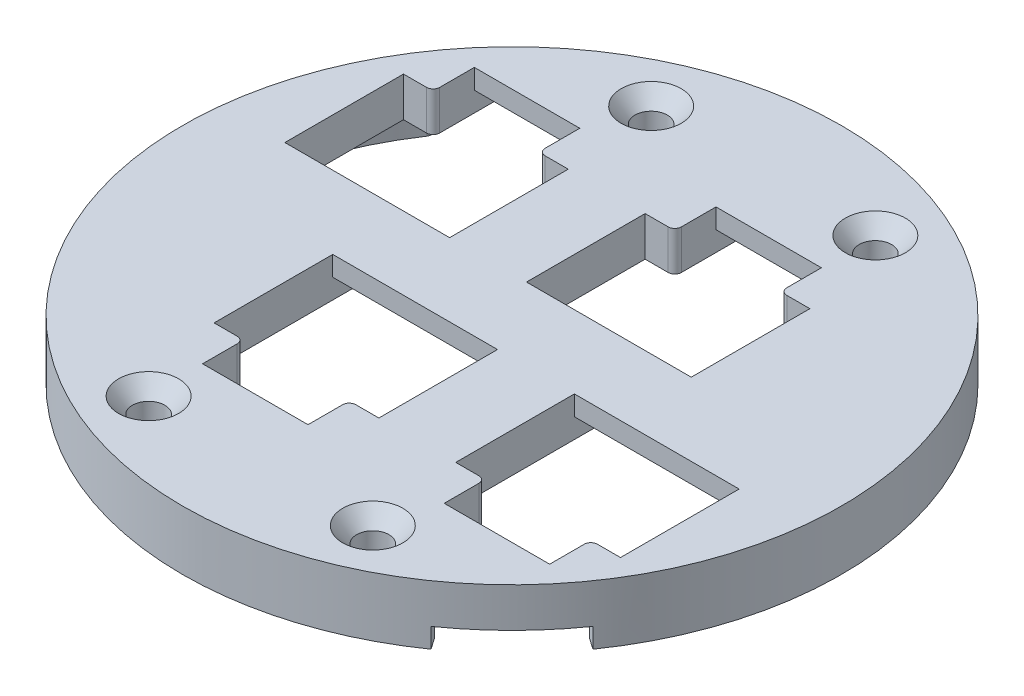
SolidWorks part; units mm, degrees
other "<a_base>-<Holes Pattern>"
ref_plane "Front Plane" through (0, 0, 0) normal (0, 0, 1) x (1, 0, 0)
ref_plane "Top Plane" through (0, 0, 0) normal (0, 1, 0) x (1, 0, 0)
ref_plane "Right Plane" through (0, 0, 0) normal (1, 0, 0) x (0, 0, -1)
inserted part "a_base"
sketch "Sketch2" plane through (0, 1.5, 0) normal (0, 1, 0) x (1, 0, 0)
  circle A0 centre (0, 0) radius 47
  circle A1 centre (0, 0) radius 50
  circle A2 centre (0, 0) radius 47 construction
  dimension "D1" = 3
extrude "Outer Ring" add sketch "Sketch2" against normal blind 9
sketch "Sketch3" plane through (0, -1.5, 0) normal (0, -1, 0) x (1, 0, 0)
  line L0 (27.5, 28.2843) -> (-9.1667, 28.2843) construction
  line L1 (9.1667, -28.2843) -> (-27.5, -28.2843) construction
  line L2 (0, 0) -> (0, 47) construction
  line L3 (47, 0) -> (-47, 0) construction
  line L4 (27.5, 28.2843) -> (27.5, 0) construction
  line L5 (-9.1667, 28.2843) -> (-9.1667, -28.2843) construction
  line L6 (9.1667, -28.2843) -> (9.1667, 28.2843) construction
  line L7 (-27.5, -28.2843) -> (-27.5, 0) construction
  line L8 (35.5, 23.5343) -> (40, 23.5343)
  line L9 (35.5, 29.7843) -> (19.5, 29.7843)
  line L10 (35.5, 29.7843) -> (35.5, 23.5343)
  line L11 (40, 23.5343) -> (40, 5.5343)
  line L12 (19.5, 29.7843) -> (19.5, 23.5343)
  line L13 (40, 5.5343) -> (15, 5.5343)
  line L14 (15, 5.5343) -> (15, 23.5343)
  line L15 (15, 23.5343) -> (19.5, 23.5343)
  line L16 (40, 14.5343) -> (15, 14.5343) construction
  line L17 (27.5, 28.2843) -> (27.5, 29.7843) construction
  line L18 (-1.1667, 29.7843) -> (-17.1667, 29.7843)
  line L19 (-17.1667, 29.7843) -> (-17.1667, 23.5343)
  line L20 (-17.1667, 23.5343) -> (-21.6667, 23.5343)
  line L21 (-21.6667, 23.5343) -> (-21.6667, 5.5343)
  line L22 (-21.6667, 5.5343) -> (3.3333, 5.5343)
  line L23 (3.3333, 5.5343) -> (3.3333, 23.5343)
  line L24 (3.3333, 23.5343) -> (-1.1667, 23.5343)
  line L25 (-1.1667, 23.5343) -> (-1.1667, 29.7843)
  line L26 (17.1667, -29.7843) -> (1.1667, -29.7843)
  line L27 (1.1667, -29.7843) -> (1.1667, -23.5343)
  line L28 (1.1667, -23.5343) -> (-3.3333, -23.5343)
  line L29 (-3.3333, -23.5343) -> (-3.3333, -5.5343)
  line L30 (-3.3333, -5.5343) -> (21.6667, -5.5343)
  line L31 (21.6667, -5.5343) -> (21.6667, -23.5343)
  line L32 (21.6667, -23.5343) -> (17.1667, -23.5343)
  line L33 (17.1667, -23.5343) -> (17.1667, -29.7843)
  line L34 (9.1667, -28.2843) -> (9.1667, -29.7843) construction
  line L35 (-19.5, -29.7843) -> (-35.5, -29.7843)
  line L36 (-35.5, -29.7843) -> (-35.5, -23.5343)
  line L37 (-35.5, -23.5343) -> (-40, -23.5343)
  line L38 (-40, -23.5343) -> (-40, -5.5343)
  line L39 (-40, -5.5343) -> (-15, -5.5343)
  line L40 (-15, -5.5343) -> (-15, -23.5343)
  line L41 (-15, -23.5343) -> (-19.5, -23.5343)
  line L42 (-19.5, -23.5343) -> (-19.5, -29.7843)
  circle A0 centre (0, 0) radius 47 construction
  dimension "D1" = 1.5
  dimension "D2" = 25
  dimension "D3" = 22.75
  dimension "D4" = 18
  dimension "D5" = 16
extrude "Finger Base Through Holes" cut sketch "Sketch3" against normal through all
sketch "Sketch4" plane through (0, -1.5, 0) normal (0, -1, 0) x (1, 0, 0)
  line L0 (40, 1.5343) -> (15, 1.5343)
  line L1 (46.975, -1.5343) -> (24.6667, -1.5343)
  line L2 (-21.6667, 5.5343) -> (3.3333, 5.5343) construction
  line L3 (-1.1667, 33.7843) -> (-17.1667, 33.7843)
  line L4 (-24.6667, 33.7843) -> (-32.6745, 33.7843)
  line L5 (-24.6667, 1.5343) -> (-46.975, 1.5343)
  line L6 (3.3333, 1.5343) -> (-21.6667, 1.5343)
  line L7 (12, 1.5343) -> (6.3333, 1.5343)
  line L8 (21.6667, -1.5343) -> (-3.3333, -1.5343)
  line L9 (17.1667, -33.7843) -> (1.1667, -33.7843)
  line L10 (-6.3333, -33.7843) -> (-12, -33.7843)
  line L11 (-19.5, -33.7843) -> (-32.6745, -33.7843)
  line L12 (-15, -1.5343) -> (-40, -1.5343)
  line L13 (-6.3333, -1.5343) -> (-12, -1.5343)
  line L14 (-1.1667, 29.7843) -> (-17.1667, 29.7843) construction
  line L15 (-35.5, -23.5343) -> (-40, -23.5343)
  line L16 (19.5, 23.5343) -> (15, 23.5343)
  line L17 (19.5, 23.5343) -> (19.5, 33.7843)
  line L18 (-17.1667, 23.5343) -> (-21.6667, 23.5343)
  line L19 (-17.1667, 23.5343) -> (-17.1667, 33.7843)
  line L20 (-19.5, -23.5343) -> (-15, -23.5343)
  line L21 (-19.5, -23.5343) -> (-19.5, -33.7843)
  line L22 (1.1667, -23.5343) -> (-3.3333, -23.5343)
  line L23 (1.1667, -23.5343) -> (1.1667, -33.7843)
  line L24 (-40, -23.5343) -> (-40, -1.5343)
  line L25 (-35.5, -23.5343) -> (-35.5, -30.8018)
  line L26 (17.1667, -23.5343) -> (21.6667, -23.5343)
  line L27 (17.1667, -23.5343) -> (17.1667, -33.7843)
  line L28 (40, 23.5343) -> (35.5, 23.5343)
  line L29 (35.5, 23.5343) -> (35.5, 30.8018)
  line L30 (40, 23.5343) -> (40, 1.5343)
  line L31 (17.0093, 38.128) -> (17.0093, -38.128) construction
  line L33 (21.6667, -5.5343) -> (-3.3333, -5.5343) construction
  line L34 (1.1667, -29.7843) -> (17.1667, -29.7843) construction
  line L35 (15, 23.5343) -> (15, 5.5343) construction
  line L36 (3.3333, 5.5343) -> (3.3333, 23.5343) construction
  line L37 (-17.0093, 38.128) -> (-17.0093, -38.128) construction
  line L38 (3.3333, 1.5343) -> (3.3333, 23.5343)
  line L39 (-1.1667, 23.5343) -> (3.3333, 23.5343)
  line L40 (6.3333, 1.5343) -> (6.3333, 33.7843)
  line L41 (-21.6667, 23.5343) -> (-21.6667, 5.5343) construction
  line L42 (-1.1667, 23.5343) -> (-1.1667, 33.7843)
  line L43 (-24.6667, 1.5343) -> (-24.6667, 33.7843)
  line L45 (-21.6667, 1.5343) -> (-21.6667, 23.5343)
  line L46 (-15, -23.5343) -> (-15, -5.5343) construction
  line L48 (-12, -1.5343) -> (-12, -33.7843)
  line L50 (-15, -1.5343) -> (-15, -23.5343)
  line L51 (-3.3333, -5.5343) -> (-3.3333, -23.5343) construction
  line L52 (32.6745, -35.7843) -> (-32.6745, -35.7843)
  line L53 (-3.3333, -1.5343) -> (-3.3333, -23.5343)
  line L55 (-6.3333, -1.5343) -> (-6.3333, -33.7843)
  line L56 (21.6667, -23.5343) -> (21.6667, -5.5343) construction
  line L58 (24.6667, -1.5343) -> (24.6667, -33.7843)
  line L60 (21.6667, -1.5343) -> (21.6667, -23.5343)
  line L61 (32.6745, 33.7843) -> (19.5, 33.7843)
  line L62 (32.6745, 33.7843) -> (32.6745, 35.7843)
  line L63 (32.6745, 35.7843) -> (-32.6745, 35.7843)
  line L64 (-32.6745, 33.7843) -> (-32.6745, 35.7843)
  line L65 (32.6745, -33.7843) -> (24.6667, -33.7843)
  line L66 (32.6745, -33.7843) -> (32.6745, -35.7843)
  line L68 (-32.6745, -33.7843) -> (-32.6745, -35.7843)
  line L70 (12, 1.5343) -> (12, 33.7843)
  line L72 (15, 1.5343) -> (15, 23.5343)
  line L73 (12, 33.7843) -> (6.3333, 33.7843)
  arc A0 (-46.975, 1.5343) -> (-35.5, -30.8018) centre (0, 0) ccw
  arc A1 (35.5, 30.8018) -> (46.975, -1.5343) centre (0, 0) cw
  circle A12 centre (0, 0) radius 47 construction
  dimension "D1" = 4
  dimension "D2" = 4
  dimension "D4" = 2
  dimension "D3" = 4
  dimension "D5" = 4
  dimension "D6" = 3
  dimension "D7" = 3
  dimension "D8" = 3
  dimension "D9" = 3
  dimension "D10" = 3
  dimension "D11" = 3
extrude "Ring Extrude" add sketch "Sketch4" along normal blind 3
sketch "Sketch6" plane through (0, -1.5, 0) normal (0, -1, 0) x (1, 0, 0)
  line L0 (19.5, 33.7843) -> (32.6745, 33.7843) construction
  line L1 (19.5, 29.7843) -> (35.5, 29.7843)
  line L2 (19.5, 29.7843) -> (19.5, 33.7843)
  line L3 (19.5, 33.7843) -> (35.5, 33.7843)
  line L4 (35.5, 29.7843) -> (35.5, 33.7843)
  line L6 (35.5, 29.7843) -> (19.5, 29.7843) construction
  line L7 (-19.5, -33.7843) -> (-32.6745, -33.7843) construction
  line L8 (-19.5, -29.7843) -> (-35.5, -29.7843)
  line L9 (-19.5, -29.7843) -> (-19.5, -33.7843)
  line L10 (-19.5, -33.7843) -> (-35.5, -33.7843)
  line L11 (-35.5, -29.7843) -> (-35.5, -33.7843)
extrude "Allowance Cut 1" cut sketch "Sketch6" along normal through all
sketch "Sketch7" plane through (0, -7.5, 0) normal (0, -1, 0) x (1, 0, 0)
  line L0 (0, 0) -> (50, 0) construction
  line L1 (0, 0) -> (0, 50) construction
  line L2 (0, 0) -> (35.3553, 35.3553) construction
  line L3 (0, 0) -> (28.6788, 40.9576) construction
  line L4 (0, 0) -> (40.9576, 28.6788) construction
  line L5 (28.6788, 40.9576) -> (26.9581, 38.5001)
  line L6 (40.9576, 28.6788) -> (38.5001, 26.9581)
  line L7 (0, 0) -> (35.3553, -35.3553) construction
  line L8 (-28.6788, -40.9576) -> (-26.9581, -38.5001)
  line L9 (-40.9576, -28.6788) -> (-38.5001, -26.9581)
  circle A0 centre (0, 0) radius 50 construction
  arc A1 (32.6745, 33.7843) -> (-35.5, -30.8018) centre (0, 0) ccw construction
  arc A2 (-32.6745, -33.7843) -> (35.5, 30.8018) centre (0, 0) ccw construction
  arc A3 (28.6788, 40.9576) -> (40.9576, 28.6788) centre (0, 0) cw
  arc A4 (26.9581, 38.5001) -> (38.5001, 26.9581) centre (0, 0) cw
  arc A5 (-38.5001, -26.9581) -> (-26.9581, -38.5001) centre (0, 0) ccw
  arc A6 (-40.9576, -28.6788) -> (-28.6788, -40.9576) centre (0, 0) ccw
  dimension "D1" = 45
  dimension "D2" = 20
extrude "Allowance Cut 2" cut sketch "Sketch7" against normal up to surface (3 mm away)
hole_wizard "CSK for #8 Flat Head Socket Cap Screw1" positions "Sketch10" profile "Sketch9" countersink size "#8" standard "ANSI Inch"
sketch "Sketch10" plane through (0, 1.5, 0) normal (0, 1, 0) x (1, 0, 0)
  point P0 (-17.0093, -38.128)
  point P3 (17.0093, -38.128)
  point P6 (17.0093, 38.128)
  point P9 (-17.0093, 38.128)
sketch "Sketch9" plane through (-17.0093, 1.5, 38.128) normal (1, 0, 0) x (0, 0, 1)
  line L0 (0, 0) -> (0, 9)
  line L1 (0, 9) -> (2.4574, 9)
  line L2 (2.4574, 9) -> (2.4574, 2.4179)
  line L3 (2.4574, 2.4179) -> (4.5593, 0)
  line L5 (4.5593, 0) -> (0, 0)
  line L6 (-2.4574, 2.4179) -> (-4.5593, 0) construction
  line L11 (0, -6.35) -> (0, 107.95) construction
  dimension "Thru Hole Dia." = 4.9149
  dimension "Thru Hole Depth" = 9
  dimension "Near C'Sink Dia." = 9.1186
  dimension "Near C'Sink Angle" = 82
sketch "Sketch11" plane through (0, -1.5, 0) normal (0, -1, 0) x (1, 0, 0)
  line L0 (-16.2705, -35.7843) -> (16.2705, -35.7843) construction
  line L2 (-30.4711, -35.7843) -> (-12, -35.7843)
  line L3 (-12, -45.4423) -> (-12, -35.7843)
  line L4 (12, -35.7843) -> (12, -45.4423)
  line L5 (-12, -1.5343) -> (-12, -33.7843) construction
  line L6 (12, 1.5343) -> (12, 33.7843) construction
  line L7 (12, -35.7843) -> (30.4711, -35.7843)
  line L8 (0, 0) -> (-45.8032, 0) construction
  line L9 (12, 35.7843) -> (30.4711, 35.7843)
  line L10 (12, 35.7843) -> (12, 45.4423)
  line L11 (-12, 45.4423) -> (-12, 35.7843)
  line L12 (-30.4711, 35.7843) -> (-12, 35.7843)
  arc A1 (-30.4711, -35.7843) -> (30.4711, -35.7843) centre (0, 0) ccw construction
  arc A5 (-30.4711, -35.7843) -> (-12, -45.4423) centre (0, 0) ccw
  arc A6 (12, -45.4423) -> (30.4711, -35.7843) centre (0, 0) ccw
  arc A7 (12, 45.4423) -> (30.4711, 35.7843) centre (0, 0) cw
  arc A8 (-30.4711, 35.7843) -> (-12, 45.4423) centre (0, 0) cw
  circle A9 centre (-17.0093, -38.128) radius 2.4574 construction
  circle A10 centre (17.0093, -38.128) radius 2.4574 construction
  circle A11 centre (17.0093, 38.128) radius 2.4574 construction
  circle A13 centre (-17.0093, 38.128) radius 2.4574 construction
  circle A14 centre (-17.0093, -38.128) radius 2.4574
  circle A16 centre (17.0093, -38.128) radius 2.4574
  circle A17 centre (17.0093, 38.128) radius 2.4574
  circle A18 centre (-17.0093, 38.128) radius 2.4574
extrude "Padding Extrude" add sketch "Sketch11" along normal up to surface (3 mm away) contours A14 L2 A5 L3 | A16 L7 L4 A6 | A17 L9 A7 L10 | A18 L12 L11 A8
fillet "Clearance Contouring" radius 1 12 edges at (26.9581, -6, 38.5001) (38.5001, -6, 26.9581) (-38.5001, -6, -26.9581) (-26.9581, -6, -38.5001) (-35.5, -1.5, -23.5343) (-19.5, -1.5, -23.5343) (1.1667, -1.5, -23.5343) (17.1667, -1.5, -23.5343) (19.5, -1.5, 23.5343) (35.5, -1.5, 23.5343) (-1.1667, -1.5, 23.5343) (-17.1667, -1.5, 23.5343)
ref_point "Ref Center"
equation "\"D1@Sketch2\"=\"width keep@values@params.sldprt\""
equation "\"D1@Outer Ring\"=3*\"width keep@values@params.sldprt\""
equation "\"D1@Sketch3\"=\"width keep@values@params.sldprt\"/2"
equation "\"D3@Sketch3\"=\"LB pivot@values@params.sldprt\""
equation "\"D5@Sketch3\"=\"finger depth@values@params.sldprt\""
equation "\"D2@Sketch4\" = \"width tab@values@params.sldprt\""
equation "\"D3@Sketch4\"=\"width tab@values@params.sldprt\""
equation "\"D5@Sketch4\"=\"width tab@values@params.sldprt\""
equation "\"D1@Sketch4\"=\"width tab@values@params.sldprt\""
equation "\"D6@Sketch4\"=\"width keep@values@params.sldprt\""
equation "\"D7@Sketch4\"=\"width keep@values@params.sldprt\""
equation "\"D8@Sketch4\"=\"width keep@values@params.sldprt\""
equation "\"D9@Sketch4\"=\"width keep@values@params.sldprt\""
equation "\"D10@Sketch4\"=\"width keep@values@params.sldprt\""
equation "\"D11@Sketch4\"=\"width keep@values@params.sldprt\""
equation "\"D4@Sketch3\"=\"finger height@values@params.sldprt\""
